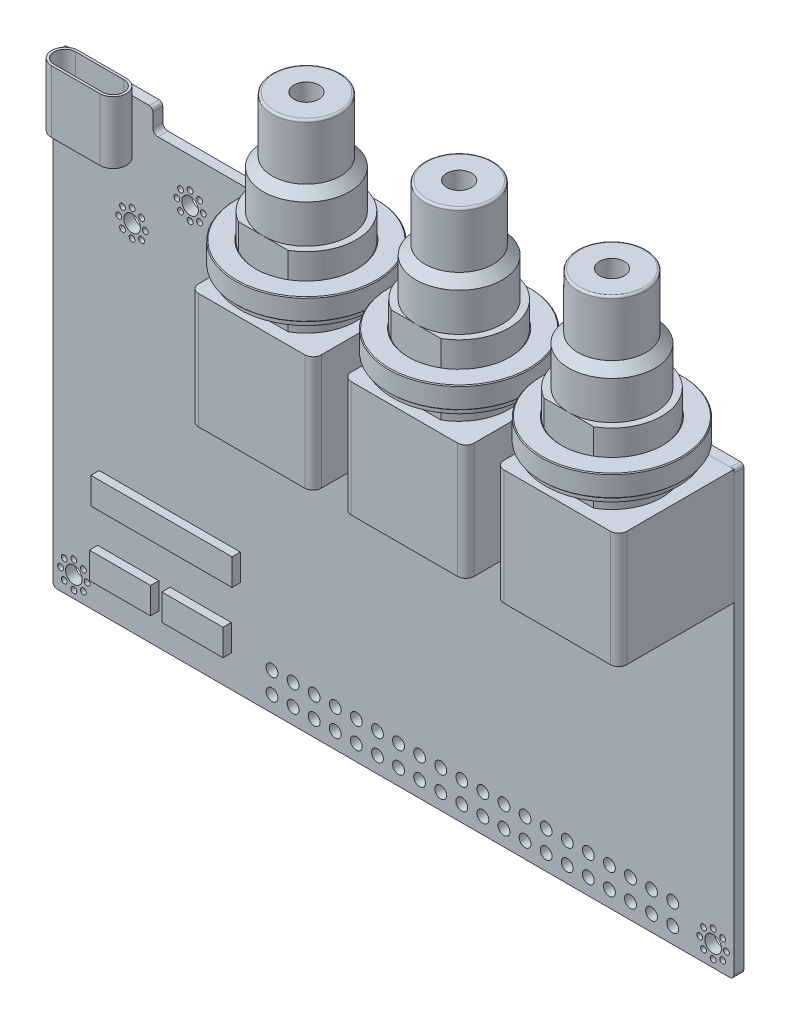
SolidWorks part; units mm, degrees
ref_plane "Front Plane" through (0, 0, 0) normal (0, 0, 1) x (1, 0, 0)
ref_plane "Top Plane" through (0, 0, 0) normal (0, 1, 0) x (1, 0, 0)
ref_plane "Right Plane" through (0, 0, 0) normal (1, 0, 0) x (0, 0, -1)
sketch "BOT" plane through (0, 0, 0) normal (0, 0, 1) x (1, 0, 0)
  line L0 (10.1712, -64.7945) -> (10.1709, -65.5945)
  line L1 (11.1708, -65.595) -> (11.1712, -64.795)
  line L2 (1.5312, -64.7903) -> (1.5308, -65.5903)
  line L3 (2.5308, -65.5908) -> (2.5312, -64.7908)
  line L4 (10.1734, -60.4645) -> (10.1728, -61.5645)
  line L5 (11.1728, -61.565) -> (11.1733, -60.465)
  line L6 (1.5333, -60.4603) -> (1.5328, -61.5603)
  line L7 (2.5328, -61.5608) -> (2.5333, -60.4608)
  line L8 (75.7902, -14.1213) -> (75.7895, -15.5437)
  line L9 (75.7895, -15.5437) -> (74.3671, -15.543)
  line L10 (74.3671, -15.543) -> (74.3678, -14.1206)
  line L11 (74.3678, -14.1206) -> (75.7902, -14.1213)
  line L12 (76.348, -16.1028) -> (25.548, -16.078)
  line L13 (25.548, -16.078) -> (25.5505, -10.998)
  line L14 (25.5505, -10.998) -> (76.3505, -11.0228)
  line L15 (76.3505, -11.0228) -> (76.348, -16.1028)
  line L16 (82.425, -63.2104) -> (82.4505, -10.8658)
  line L17 (81.9508, -10.3655) -> (0.9508, -10.326)
  line L18 (0.4506, -10.8258) -> (0.4481, -18.3065)
  line L19 (0.4481, -18.3065) -> (0.4249, -65.8599)
  line L20 (0.9235, -66.326) -> (6.1995, -66.3286)
  line L21 (6.1995, -66.3286) -> (12.0127, -66.3314)
  line L22 (12.4366, -65.8586) -> (12.4374, -64.1949)
  line L23 (13.0498, -63.5856) -> (82.0209, -63.6192)
  line L24 (10.1712, -64.7945) -> (10.1709, -65.5945)
  line L25 (11.1708, -65.595) -> (11.1712, -64.795)
  line L26 (1.5312, -64.7903) -> (1.5308, -65.5903)
  line L27 (2.5308, -65.5908) -> (2.5312, -64.7908)
  line L28 (10.1734, -60.4645) -> (10.1728, -61.5645)
  line L29 (11.1728, -61.565) -> (11.1733, -60.465)
  line L30 (1.5333, -60.4603) -> (1.5328, -61.5603)
  line L31 (2.5328, -61.5608) -> (2.5333, -60.4608)
  line L32 (75.7902, -14.1213) -> (75.7895, -15.5437)
  line L33 (75.7895, -15.5437) -> (74.3671, -15.543)
  line L34 (74.3671, -15.543) -> (74.3678, -14.1206)
  line L35 (74.3678, -14.1206) -> (75.7902, -14.1213)
  line L36 (76.348, -16.1028) -> (25.548, -16.078)
  line L37 (25.548, -16.078) -> (25.5505, -10.998)
  line L38 (25.5505, -10.998) -> (76.3505, -11.0228)
  line L39 (76.3505, -11.0228) -> (76.348, -16.1028)
  line L40 (82.425, -63.2104) -> (82.4505, -10.8658)
  line L41 (81.9508, -10.3655) -> (0.9508, -10.326)
  line L42 (0.4506, -10.8258) -> (0.4481, -18.3065)
  line L43 (0.4481, -18.3065) -> (0.4249, -65.8599)
  line L44 (0.9235, -66.326) -> (6.1995, -66.3286)
  line L45 (6.1995, -66.3286) -> (12.0127, -66.3314)
  line L46 (12.4366, -65.8586) -> (12.4374, -64.1949)
  line L47 (13.0498, -63.5856) -> (82.0209, -63.6192)
  line L48 (77.0382, -15.3161) -> (76.4548, -15.3158) construction
  line L49 (78.0554, -12.7766) -> (76.583, -12.7759) construction
  line L50 (25.2221, -15.4179) -> (23.6108, -15.4171) construction
  line L51 (25.2235, -12.4969) -> (23.6122, -12.4961) construction
  line L52 (77.0382, -15.3161) -> (76.4548, -15.3158) construction
  line L53 (78.0554, -12.7766) -> (76.583, -12.7759) construction
  line L54 (25.2221, -15.4179) -> (23.6108, -15.4171) construction
  line L55 (25.2235, -12.4969) -> (23.6122, -12.4961) construction
  circle A0 centre (9.2428, -61.5141) radius 0.325
  circle A1 centre (3.4628, -61.5112) radius 0.325
  circle A2 centre (4.5496, -12.8278) radius 0.35
  circle A3 centre (4.1001, -11.6775) radius 0.35
  circle A4 centre (2.9504, -11.227) radius 0.35
  circle A5 centre (1.8001, -11.6764) radius 0.35
  circle A6 centre (1.3496, -12.8262) radius 0.35
  circle A7 centre (4.099, -13.9776) radius 0.35
  circle A8 centre (2.9488, -14.427) radius 0.35
  circle A9 centre (2.9496, -12.827) radius 2
  circle A10 centre (1.799, -13.9764) radius 0.35
  circle A11 centre (81.5496, -12.8653) radius 0.35
  circle A12 centre (81.1001, -11.7151) radius 0.35
  circle A13 centre (79.9503, -11.2645) radius 0.35
  circle A14 centre (78.8001, -11.714) radius 0.35
  circle A15 centre (78.3496, -12.8637) radius 0.35
  circle A16 centre (81.099, -14.0151) radius 0.35
  circle A17 centre (79.9488, -14.4645) radius 0.35
  circle A18 centre (79.9496, -12.8645) radius 2
  circle A19 centre (78.799, -14.014) radius 0.35
  circle A20 centre (11.545, -53.01) radius 0.35
  circle A21 centre (11.0956, -51.8597) radius 0.35
  circle A22 centre (9.9458, -51.4092) radius 0.35
  circle A23 centre (8.7955, -51.8586) radius 0.35
  circle A24 centre (8.345, -53.0084) radius 0.35
  circle A25 centre (11.0944, -54.1598) radius 0.35
  circle A26 centre (9.9442, -54.6092) radius 0.35
  circle A27 centre (9.945, -53.0092) radius 2
  circle A28 centre (8.7944, -54.1586) radius 0.35
  circle A29 centre (18.5274, -58.3346) radius 0.35
  circle A30 centre (18.078, -57.1844) radius 0.35
  circle A31 centre (16.9282, -56.7338) radius 0.35
  circle A32 centre (15.7779, -57.1832) radius 0.35
  circle A33 centre (15.3274, -58.333) radius 0.35
  circle A34 centre (18.0768, -59.4844) radius 0.35
  circle A35 centre (16.9266, -59.9338) radius 0.35
  circle A36 centre (16.9274, -58.3338) radius 2
  circle A37 centre (15.7768, -59.4833) radius 0.35
  circle A38 centre (67.5274, -58.3585) radius 0.35
  circle A39 centre (67.078, -57.2083) radius 0.35
  circle A40 centre (65.9282, -56.7577) radius 0.35
  circle A41 centre (64.7779, -57.2071) radius 0.35
  circle A42 centre (64.3274, -58.3569) radius 0.35
  circle A43 centre (67.0768, -59.5083) radius 0.35
  circle A44 centre (65.9266, -59.9577) radius 0.35
  circle A45 centre (65.9274, -58.3577) radius 2
  circle A46 centre (64.7768, -59.5072) radius 0.35
  circle A47 centre (72.5386, -14.8309) radius 0.7112
  circle A48 centre (69.9986, -14.8297) radius 0.7112
  circle A49 centre (67.4586, -14.8284) radius 0.7112
  circle A50 centre (64.9186, -14.8272) radius 0.7112
  circle A51 centre (62.3786, -14.826) radius 0.7112
  circle A52 centre (59.8386, -14.8247) radius 0.7112
  circle A53 centre (57.2986, -14.8235) radius 0.7112
  circle A54 centre (54.7586, -14.8222) radius 0.7112
  circle A55 centre (52.2186, -14.821) radius 0.7112
  circle A56 centre (49.6786, -14.8198) radius 0.7112
  circle A57 centre (47.1386, -14.8185) radius 0.7112
  circle A58 centre (44.5986, -14.8173) radius 0.7112
  circle A59 centre (42.0586, -14.8161) radius 0.7112
  circle A60 centre (39.5186, -14.8148) radius 0.7112
  circle A61 centre (36.9786, -14.8136) radius 0.7112
  circle A62 centre (34.4386, -14.8123) radius 0.7112
  circle A63 centre (31.8986, -14.8111) radius 0.7112
  circle A64 centre (29.3586, -14.8099) radius 0.7112
  circle A65 centre (26.8186, -14.8086) radius 0.7112
  circle A66 centre (75.0799, -12.2922) radius 0.7112
  circle A67 centre (72.5399, -12.2909) radius 0.7112
  circle A68 centre (69.9999, -12.2897) radius 0.7112
  circle A69 centre (67.4599, -12.2884) radius 0.7112
  circle A70 centre (64.9199, -12.2872) radius 0.7112
  circle A71 centre (62.3799, -12.286) radius 0.7112
  circle A72 centre (59.8399, -12.2847) radius 0.7112
  circle A73 centre (57.2999, -12.2835) radius 0.7112
  circle A74 centre (54.7599, -12.2822) radius 0.7112
  circle A75 centre (52.2199, -12.281) radius 0.7112
  circle A76 centre (49.6799, -12.2798) radius 0.7112
  circle A77 centre (47.1399, -12.2785) radius 0.7112
  circle A78 centre (44.5999, -12.2773) radius 0.7112
  circle A79 centre (42.0599, -12.2761) radius 0.7112
  circle A80 centre (39.5199, -12.2748) radius 0.7112
  circle A81 centre (36.9799, -12.2736) radius 0.7112
  circle A82 centre (34.4399, -12.2723) radius 0.7112
  circle A83 centre (31.8999, -12.2711) radius 0.7112
  circle A84 centre (29.3599, -12.2699) radius 0.7112
  circle A85 centre (26.8199, -12.2686) radius 0.7112
  circle A86 centre (61.6924, -56.2094) radius 1.5
  circle A87 centre (51.5924, -56.2045) radius 1.5
  circle A88 centre (54.1449, -51.1057) radius 0.8
  circle A89 centre (56.6449, -51.107) radius 0.8
  circle A90 centre (80.0924, -56.2184) radius 1.5
  circle A91 centre (69.9924, -56.2135) radius 1.5
  circle A92 centre (72.5449, -51.1147) radius 0.8
  circle A93 centre (75.0449, -51.1159) radius 0.8
  circle A94 centre (43.2924, -56.2004) radius 1.5
  circle A95 centre (33.1924, -56.1955) radius 1.5
  circle A96 centre (35.7449, -51.0968) radius 0.8
  circle A97 centre (38.2449, -51.098) radius 0.8
  circle A98 centre (9.2428, -61.5141) radius 0.325
  circle A99 centre (3.4628, -61.5112) radius 0.325
  circle A100 centre (4.5496, -12.8278) radius 0.35
  circle A101 centre (4.1001, -11.6775) radius 0.35
  circle A102 centre (2.9504, -11.227) radius 0.35
  circle A103 centre (1.8001, -11.6764) radius 0.35
  circle A104 centre (1.3496, -12.8262) radius 0.35
  circle A105 centre (4.099, -13.9776) radius 0.35
  circle A106 centre (2.9488, -14.427) radius 0.35
  circle A107 centre (2.9496, -12.827) radius 2
  circle A108 centre (1.799, -13.9764) radius 0.35
  circle A109 centre (81.5496, -12.8653) radius 0.35
  circle A110 centre (81.1001, -11.7151) radius 0.35
  circle A111 centre (79.9503, -11.2645) radius 0.35
  circle A112 centre (78.8001, -11.714) radius 0.35
  circle A113 centre (78.3496, -12.8637) radius 0.35
  circle A114 centre (81.099, -14.0151) radius 0.35
  circle A115 centre (79.9488, -14.4645) radius 0.35
  circle A116 centre (79.9496, -12.8645) radius 2
  circle A117 centre (78.799, -14.014) radius 0.35
  circle A118 centre (11.545, -53.01) radius 0.35
  circle A119 centre (11.0956, -51.8597) radius 0.35
  circle A120 centre (9.9458, -51.4092) radius 0.35
  circle A121 centre (8.7955, -51.8586) radius 0.35
  circle A122 centre (8.345, -53.0084) radius 0.35
  circle A123 centre (11.0944, -54.1598) radius 0.35
  circle A124 centre (9.9442, -54.6092) radius 0.35
  circle A125 centre (9.945, -53.0092) radius 2
  circle A126 centre (8.7944, -54.1586) radius 0.35
  circle A127 centre (18.5274, -58.3346) radius 0.35
  circle A128 centre (18.078, -57.1844) radius 0.35
  circle A129 centre (16.9282, -56.7338) radius 0.35
  circle A130 centre (15.7779, -57.1832) radius 0.35
  circle A131 centre (15.3274, -58.333) radius 0.35
  circle A132 centre (18.0768, -59.4844) radius 0.35
  circle A133 centre (16.9266, -59.9338) radius 0.35
  circle A134 centre (16.9274, -58.3338) radius 2
  circle A135 centre (15.7768, -59.4833) radius 0.35
  circle A136 centre (67.5274, -58.3585) radius 0.35
  circle A137 centre (67.078, -57.2083) radius 0.35
  circle A138 centre (65.9282, -56.7577) radius 0.35
  circle A139 centre (64.7779, -57.2071) radius 0.35
  circle A140 centre (64.3274, -58.3569) radius 0.35
  circle A141 centre (67.0768, -59.5083) radius 0.35
  circle A142 centre (65.9266, -59.9577) radius 0.35
  circle A143 centre (65.9274, -58.3577) radius 2
  circle A144 centre (64.7768, -59.5072) radius 0.35
  circle A145 centre (72.5386, -14.8309) radius 0.7112
  circle A146 centre (69.9986, -14.8297) radius 0.7112
  circle A147 centre (67.4586, -14.8284) radius 0.7112
  circle A148 centre (64.9186, -14.8272) radius 0.7112
  circle A149 centre (62.3786, -14.826) radius 0.7112
  circle A150 centre (59.8386, -14.8247) radius 0.7112
  circle A151 centre (57.2986, -14.8235) radius 0.7112
  circle A152 centre (54.7586, -14.8222) radius 0.7112
  circle A153 centre (52.2186, -14.821) radius 0.7112
  circle A154 centre (49.6786, -14.8198) radius 0.7112
  circle A155 centre (47.1386, -14.8185) radius 0.7112
  circle A156 centre (44.5986, -14.8173) radius 0.7112
  circle A157 centre (42.0586, -14.8161) radius 0.7112
  circle A158 centre (39.5186, -14.8148) radius 0.7112
  circle A159 centre (36.9786, -14.8136) radius 0.7112
  circle A160 centre (34.4386, -14.8123) radius 0.7112
  circle A161 centre (31.8986, -14.8111) radius 0.7112
  circle A162 centre (29.3586, -14.8099) radius 0.7112
  circle A163 centre (26.8186, -14.8086) radius 0.7112
  circle A164 centre (75.0799, -12.2922) radius 0.7112
  circle A165 centre (72.5399, -12.2909) radius 0.7112
  circle A166 centre (69.9999, -12.2897) radius 0.7112
  circle A167 centre (67.4599, -12.2884) radius 0.7112
  circle A168 centre (64.9199, -12.2872) radius 0.7112
  circle A169 centre (62.3799, -12.286) radius 0.7112
  circle A170 centre (59.8399, -12.2847) radius 0.7112
  circle A171 centre (57.2999, -12.2835) radius 0.7112
  circle A172 centre (54.7599, -12.2822) radius 0.7112
  circle A173 centre (52.2199, -12.281) radius 0.7112
  circle A174 centre (49.6799, -12.2798) radius 0.7112
  circle A175 centre (47.1399, -12.2785) radius 0.7112
  circle A176 centre (44.5999, -12.2773) radius 0.7112
  circle A177 centre (42.0599, -12.2761) radius 0.7112
  circle A178 centre (39.5199, -12.2748) radius 0.7112
  circle A179 centre (36.9799, -12.2736) radius 0.7112
  circle A180 centre (34.4399, -12.2723) radius 0.7112
  circle A181 centre (31.8999, -12.2711) radius 0.7112
  circle A182 centre (29.3599, -12.2699) radius 0.7112
  circle A183 centre (26.8199, -12.2686) radius 0.7112
  circle A184 centre (61.6924, -56.2094) radius 1.5
  circle A185 centre (51.5924, -56.2045) radius 1.5
  circle A186 centre (54.1449, -51.1057) radius 0.8
  circle A187 centre (56.6449, -51.107) radius 0.8
  circle A188 centre (80.0924, -56.2184) radius 1.5
  circle A189 centre (69.9924, -56.2135) radius 1.5
  circle A190 centre (72.5449, -51.1147) radius 0.8
  circle A191 centre (75.0449, -51.1159) radius 0.8
  circle A192 centre (43.2924, -56.2004) radius 1.5
  circle A193 centre (33.1924, -56.1955) radius 1.5
  circle A194 centre (35.7449, -51.0968) radius 0.8
  circle A195 centre (38.2449, -51.098) radius 0.8
  arc A196 (10.1709, -65.5945) -> (11.1708, -65.595) centre (10.6708, -65.5948) ccw
  arc A197 (11.1712, -64.795) -> (10.1712, -64.7945) centre (10.6712, -64.7948) ccw
  arc A198 (1.5308, -65.5903) -> (2.5308, -65.5908) centre (2.0308, -65.5906) ccw
  arc A199 (2.5312, -64.7908) -> (1.5312, -64.7903) centre (2.0312, -64.7906) ccw
  arc A200 (10.1728, -61.5645) -> (11.1728, -61.565) centre (10.6728, -61.5648) ccw
  arc A201 (11.1733, -60.465) -> (10.1734, -60.4645) centre (10.6734, -60.4648) ccw
  arc A202 (1.5328, -61.5603) -> (2.5328, -61.5608) centre (2.0328, -61.5605) ccw
  arc A203 (2.5333, -60.4608) -> (1.5333, -60.4603) centre (2.0333, -60.4606) ccw
  arc A204 (82.4505, -10.8658) -> (81.9508, -10.3655) centre (81.9505, -10.8655) ccw
  arc A205 (0.9508, -10.326) -> (0.4506, -10.8258) centre (0.9505, -10.826) ccw
  arc A206 (0.4249, -65.8599) -> (0.9235, -66.326) centre (0.9237, -65.826) ccw
  arc A207 (12.0127, -66.3314) -> (12.4366, -65.8586) centre (11.9606, -65.8583) ccw
  arc A208 (13.0498, -63.5856) -> (12.4374, -64.1949) centre (13.0495, -64.1977) ccw
  arc A209 (82.0209, -63.6192) -> (82.425, -63.2104) centre (82.016, -63.2102) ccw
  arc A210 (10.1709, -65.5945) -> (11.1708, -65.595) centre (10.6708, -65.5948) ccw
  arc A211 (11.1712, -64.795) -> (10.1712, -64.7945) centre (10.6712, -64.7948) ccw
  arc A212 (1.5308, -65.5903) -> (2.5308, -65.5908) centre (2.0308, -65.5906) ccw
  arc A213 (2.5312, -64.7908) -> (1.5312, -64.7903) centre (2.0312, -64.7906) ccw
  arc A214 (10.1728, -61.5645) -> (11.1728, -61.565) centre (10.6728, -61.5648) ccw
  arc A215 (11.1733, -60.465) -> (10.1734, -60.4645) centre (10.6734, -60.4648) ccw
  arc A216 (1.5328, -61.5603) -> (2.5328, -61.5608) centre (2.0328, -61.5605) ccw
  arc A217 (2.5333, -60.4608) -> (1.5333, -60.4603) centre (2.0333, -60.4606) ccw
  arc A218 (82.4505, -10.8658) -> (81.9508, -10.3655) centre (81.9505, -10.8655) ccw
  arc A219 (0.9508, -10.326) -> (0.4506, -10.8258) centre (0.9505, -10.826) ccw
  arc A220 (0.4249, -65.8599) -> (0.9235, -66.326) centre (0.9237, -65.826) ccw
  arc A221 (12.0127, -66.3314) -> (12.4366, -65.8586) centre (11.9606, -65.8583) ccw
  arc A222 (13.0498, -63.5856) -> (12.4374, -64.1949) centre (13.0495, -64.1977) ccw
  arc A223 (82.0209, -63.6192) -> (82.425, -63.2104) centre (82.016, -63.2102) ccw
  text T0 "1" font "SWTXT" height 0.889
  text T1 "21" font "SWTXT" height 0.889
  text T2 "20" font "SWTXT" height 0.889
  text T3 "40" font "SWTXT" height 0.889
  text T4 "1" font "SWTXT" height 0.889
  text T5 "21" font "SWTXT" height 0.889
  text T6 "20" font "SWTXT" height 0.889
  text T7 "40" font "SWTXT" height 0.889
sketch "TOP" plane through (0, 0, 0) normal (0, 0, 1) x (1, 0, 0)
  line L0 (1.427, 57.464) -> (1.427, 50.114) construction
  line L1 (10.427, 50.114) -> (10.427, 57.464) construction
  line L2 (1.427, 50.114) -> (10.427, 50.114) construction
  line L3 (6.8368, 1.616) -> (6.8368, 0.416) construction
  line L4 (9.4368, 1.616) -> (9.4368, 0.416) construction
  line L5 (5.3719, 7.01) -> (12.7379, 7.01) construction
  line L6 (14.1021, 7.01) -> (21.4681, 7.01) construction
  line L7 (5.555, 14.9028) -> (22.555, 14.9028) construction
  line L730 (5.555, 14.9028) -> (5.555, 11.7028) construction
  line L731 (5.555, 11.7028) -> (22.555, 11.7028) construction
  line L732 (22.555, 11.7028) -> (22.555, 14.9028) construction
  line L806 (10.427, 57.464) -> (1.427, 57.464) construction
  line L865 (5.3719, 3.835) -> (5.3719, 7.01) construction
  line L866 (12.7379, 3.835) -> (5.3719, 3.835) construction
  line L867 (12.7379, 7.01) -> (12.7379, 3.835) construction
  line L918 (14.1021, 3.835) -> (14.1021, 7.01) construction
  line L919 (21.4681, 3.835) -> (14.1021, 3.835) construction
  line L920 (21.4681, 7.01) -> (21.4681, 3.835) construction
  line L1002 (48.814, 53.2538) -> (48.814, 39.3428) construction
  line L1003 (48.814, 39.3428) -> (63.614, 39.3428) construction
  line L1004 (63.614, 39.3428) -> (63.614, 53.2538) construction
  line L1005 (63.614, 53.2538) -> (48.814, 53.2538) construction
  line L1006 (60.614, 53.2538) -> (60.614, 62.1538) construction
  line L1007 (60.614, 62.1538) -> (51.814, 62.1538) construction
  line L1008 (51.814, 62.1538) -> (51.814, 53.2536) construction
  line L1009 (67.214, 53.2538) -> (67.214, 39.3428) construction
  line L1010 (67.214, 39.3428) -> (82.014, 39.3428) construction
  line L1011 (82.014, 39.3428) -> (82.014, 53.2538) construction
  line L1012 (82.014, 53.2538) -> (67.214, 53.2538) construction
  line L1013 (79.014, 53.2538) -> (79.014, 62.1538) construction
  line L1014 (79.014, 62.1538) -> (70.214, 62.1538) construction
  line L1015 (70.214, 62.1538) -> (70.214, 53.2536) construction
  line L1016 (30.414, 53.2538) -> (30.414, 39.3428) construction
  line L1017 (30.414, 39.3428) -> (45.214, 39.3428) construction
  line L1018 (45.214, 39.3428) -> (45.214, 53.2538) construction
  line L1019 (45.214, 53.2538) -> (30.414, 53.2538) construction
  line L1020 (42.214, 53.2538) -> (42.214, 62.1538) construction
  line L1021 (42.214, 62.1538) -> (33.414, 62.1538) construction
  line L1022 (33.414, 62.1538) -> (33.414, 53.2536) construction
  line L1039 (9.0368, 0.416) -> (9.4368, 0.416) construction
  line L1042 (6.8368, 0.416) -> (7.2368, 0.416) construction
  line L1044 (9.4368, 1.616) -> (6.8368, 1.616) construction
  line L1046 (82, 52.8447) -> (82, 0.5)
  line L1047 (81.5, 0) -> (0.5, 0)
  line L1048 (0, 0.5) -> (0.0012, 7.9807)
  line L1049 (0.0012, 7.9807) -> (0.0012, 55.5342)
  line L1050 (0.5, 56) -> (5.776, 56)
  line L1051 (5.776, 56) -> (11.5892, 56)
  line L1052 (12.0128, 55.5269) -> (12.0128, 53.8632)
  line L1053 (12.625, 53.2536) -> (81.5961, 53.2536)
  circle A0 centre (2.5, 2.5) radius 1
  circle A1 centre (16.5, 48) radius 1
  circle A2 centre (9.515, 42.6788) radius 1
  circle A3 centre (4.1, 2.5) radius 0.35
  circle A4 centre (3.65, 1.35) radius 0.35
  circle A5 centre (2.5, 0.9) radius 0.35
  circle A6 centre (1.35, 1.35) radius 0.35
  circle A7 centre (0.9, 2.5) radius 0.35
  circle A8 centre (3.65, 3.65) radius 0.35
  circle A9 centre (2.5, 4.1) radius 0.35
  circle A11 centre (1.35, 3.65) radius 0.35
  circle A12 centre (81.1, 2.5) radius 0.35
  circle A13 centre (80.65, 1.35) radius 0.35
  circle A14 centre (79.5, 0.9) radius 0.35
  circle A15 centre (78.35, 1.35) radius 0.35
  circle A16 centre (77.9, 2.5) radius 0.35
  circle A17 centre (80.65, 3.65) radius 0.35
  circle A18 centre (79.5, 4.1) radius 0.35
  circle A20 centre (78.35, 3.65) radius 0.35
  circle A21 centre (11.115, 42.6788) radius 0.35
  circle A22 centre (10.665, 41.5288) radius 0.35
  circle A23 centre (9.515, 41.0788) radius 0.35
  circle A24 centre (8.365, 41.5288) radius 0.35
  circle A25 centre (7.915, 42.6788) radius 0.35
  circle A26 centre (10.665, 43.8288) radius 0.35
  circle A27 centre (9.515, 44.2788) radius 0.35
  circle A29 centre (8.365, 43.8288) radius 0.35
  circle A30 centre (18.1, 48) radius 0.35
  circle A31 centre (17.65, 46.85) radius 0.35
  circle A32 centre (16.5, 46.4) radius 0.35
  circle A33 centre (15.35, 46.85) radius 0.35
  circle A34 centre (14.9, 48) radius 0.35
  circle A35 centre (17.65, 49.15) radius 0.35
  circle A36 centre (16.5, 49.6) radius 0.35
  circle A38 centre (15.35, 49.15) radius 0.35
  circle A39 centre (67.1, 48) radius 0.35
  circle A40 centre (66.65, 46.85) radius 0.35
  circle A41 centre (65.5, 46.4) radius 0.35
  circle A42 centre (64.35, 46.85) radius 0.35
  circle A43 centre (63.9, 48) radius 0.35
  circle A44 centre (66.65, 49.15) radius 0.35
  circle A45 centre (65.5, 49.6) radius 0.35
  circle A47 centre (64.35, 49.15) radius 0.35
  circle A48 centre (72.09, 4.47) radius 0.7112
  circle A49 centre (69.55, 4.47) radius 0.7112
  circle A50 centre (67.01, 4.47) radius 0.7112
  circle A51 centre (64.47, 4.47) radius 0.7112
  circle A52 centre (61.93, 4.47) radius 0.7112
  circle A53 centre (59.39, 4.47) radius 0.7112
  circle A54 centre (56.85, 4.47) radius 0.7112
  circle A55 centre (54.31, 4.47) radius 0.7112
  circle A56 centre (51.77, 4.47) radius 0.7112
  circle A57 centre (49.23, 4.47) radius 0.7112
  circle A58 centre (46.69, 4.47) radius 0.7112
  circle A59 centre (44.15, 4.47) radius 0.7112
  circle A60 centre (41.61, 4.47) radius 0.7112
  circle A61 centre (39.07, 4.47) radius 0.7112
  circle A62 centre (36.53, 4.47) radius 0.7112
  circle A63 centre (33.99, 4.47) radius 0.7112
  circle A64 centre (31.45, 4.47) radius 0.7112
  circle A65 centre (28.91, 4.47) radius 0.7112
  circle A66 centre (26.37, 4.47) radius 0.7112
  circle A67 centre (74.63, 1.93) radius 0.7112
  circle A68 centre (72.09, 1.93) radius 0.7112
  circle A69 centre (69.55, 1.93) radius 0.7112
  circle A70 centre (67.01, 1.93) radius 0.7112
  circle A71 centre (64.47, 1.93) radius 0.7112
  circle A72 centre (61.93, 1.93) radius 0.7112
  circle A73 centre (59.39, 1.93) radius 0.7112
  circle A74 centre (56.85, 1.93) radius 0.7112
  circle A75 centre (54.31, 1.93) radius 0.7112
  circle A76 centre (51.77, 1.93) radius 0.7112
  circle A77 centre (49.23, 1.93) radius 0.7112
  circle A78 centre (46.69, 1.93) radius 0.7112
  circle A79 centre (44.15, 1.93) radius 0.7112
  circle A80 centre (41.61, 1.93) radius 0.7112
  circle A81 centre (39.07, 1.93) radius 0.7112
  circle A82 centre (36.53, 1.93) radius 0.7112
  circle A83 centre (33.99, 1.93) radius 0.7112
  circle A84 centre (31.45, 1.93) radius 0.7112
  circle A85 centre (28.91, 1.93) radius 0.7112
  circle A86 centre (26.37, 1.93) radius 0.7112
  circle A87 centre (65.5, 48) radius 1
  circle A88 centre (79.5, 2.5) radius 1
  circle A89 centre (74.63, 4.47) radius 0.7112
  arc A107 (8.1368, 0.016) -> (9.0368, 0.416) centre (8.2268, 1.026) ccw construction
  arc A108 (7.2368, 0.416) -> (8.1368, 0.016) centre (8.105, 1.1569) ccw construction
  arc A109 (81.5, 0) -> (82, 0.5) centre (81.5, 0.5) ccw
  arc A110 (0, 0.5) -> (0.5, 0) centre (0.5, 0.5) ccw
  arc A111 (0.5, 56) -> (0.0012, 55.5342) centre (0.5, 55.5) ccw
  arc A112 (12.0128, 55.5269) -> (11.5892, 56) centre (11.5369, 55.5269) ccw
  arc A113 (12.0128, 53.8632) -> (12.625, 53.2536) centre (12.625, 53.8658) ccw
  arc A114 (82, 52.8447) -> (81.5961, 53.2536) centre (81.591, 52.8447) ccw
extrude "Boss-Extrude1" add sketch "TOP" against normal blind 1.2
sketch "Sketch3" plane through (0, 0, 0) normal (0, 0, 1) x (1, 0, 0)
  line L0 (5.555, 14.9028) -> (5.555, 11.7028) construction
  line L1 (5.555, 14.9028) -> (22.555, 14.9028) construction
  line L2 (22.555, 11.7028) -> (22.555, 14.9028) construction
  line L3 (5.555, 11.7028) -> (22.555, 11.7028) construction
  line L4 (5.3719, 7.01) -> (12.7379, 7.01) construction
  line L5 (5.3719, 3.835) -> (5.3719, 7.01) construction
  line L6 (12.7379, 7.01) -> (12.7379, 3.835) construction
  line L7 (14.1021, 3.835) -> (14.1021, 7.01) construction
  line L8 (14.1021, 7.01) -> (21.4681, 7.01) construction
  line L9 (21.4681, 7.01) -> (21.4681, 3.835) construction
  line L10 (21.4681, 3.835) -> (14.1021, 3.835) construction
  line L11 (12.7379, 3.835) -> (5.3719, 3.835) construction
  line L12 (5.555, 14.9028) -> (5.555, 11.7028)
  line L13 (5.555, 14.9028) -> (22.555, 14.9028)
  line L14 (22.555, 11.7028) -> (22.555, 14.9028)
  line L15 (5.555, 11.7028) -> (22.555, 11.7028)
  line L16 (5.3719, 7.01) -> (12.7379, 7.01)
  line L17 (5.3719, 3.835) -> (5.3719, 7.01)
  line L18 (12.7379, 7.01) -> (12.7379, 3.835)
  line L19 (14.1021, 3.835) -> (14.1021, 7.01)
  line L20 (14.1021, 7.01) -> (21.4681, 7.01)
  line L21 (21.4681, 7.01) -> (21.4681, 3.835)
  line L22 (21.4681, 3.835) -> (14.1021, 3.835)
  line L23 (12.7379, 3.835) -> (5.3719, 3.835)
extrude "Boss-Extrude2" add sketch "Sketch3" along normal blind 1 separate body
ref_plane "Plane1" through (0, 57.464, 0) normal (0, 1, 0) x (1, 0, 0)
sketch "Sketch4" plane through (0, 57.464, 0) normal (0, 1, 0) x (1, 0, 0)
  line L0 (3.027, -1.6) -> (8.827, -1.6) construction
  line L1 (3.027, 0) -> (8.827, 0)
  line L2 (3.027, -3.2) -> (8.827, -3.2)
  line L3 (5.927, -1.6) -> (5.927, 0) construction
  line L4 (10.427, 0) -> (1.427, 0) construction
  line L5 (10.427, -1.6) -> (1.427, -1.6) construction
  arc A0 (3.027, 0) -> (3.027, -3.2) centre (3.027, -1.6) ccw
  arc A1 (8.827, -3.2) -> (8.827, 0) centre (8.827, -1.6) ccw
  point P2 (5.927, -1.6)
  dimension "D1" = 3.2
  dimension "D2" = 9
extrude "Boss-Extrude3" add sketch "Sketch4" against normal blind 7.5 separate body
shell "Shell2" thickness 0.3
sketch "Sketch5" plane through (0, 0, 0) normal (0, 0, 1) x (1, 0, 0)
  line L1 (30.414, 53.2538) -> (45.214, 53.2538)
  line L2 (30.414, 53.2538) -> (30.414, 39.3428)
  line L3 (30.414, 39.3428) -> (45.214, 39.3428)
  line L4 (45.214, 53.2538) -> (45.214, 39.3428)
  line L5 (48.814, 53.2538) -> (63.614, 53.2538)
  line L6 (48.814, 53.2538) -> (48.814, 39.3428)
  line L7 (48.814, 39.3428) -> (63.614, 39.3428)
  line L8 (63.614, 53.2538) -> (63.614, 39.3428)
  line L9 (67.214, 53.2538) -> (82.014, 53.2538)
  line L10 (67.214, 53.2538) -> (67.214, 39.3428)
  line L11 (67.214, 39.3428) -> (82.014, 39.3428)
  line L12 (82.014, 53.2538) -> (82.014, 39.3428)
extrude "Boss-Extrude4" add sketch "Sketch5" along normal blind 13.9 separate body
fillet "Fillet1" radius 1 2 edges at (67.214, 46.2983, 13.9) (82.014, 46.2983, 13.9)
fillet "Fillet2" radius 1 2 edges at (63.614, 46.2983, 13.9) (48.814, 46.2983, 13.9)
fillet "Fillet3" radius 1 2 edges at (45.214, 46.2983, 13.9) (30.414, 46.2983, 13.9)
sketch "Sketch6" plane through (0, 53.2538, 0) normal (0, 1, 0) x (1, 0, 0)
  line L0 (37.814, -13.9) -> (37.814, 0) construction
  line L2 (81.5, 0) -> (0.5, 0) construction
  line L3 (56.214, -13.9) -> (56.214, 0) construction
  line L5 (74.614, -13.9) -> (74.614, 0) construction
  line L8 (81.5961, 1.2) -> (12.625, 1.2) construction
  circle A0 centre (37.814, -7.3) radius 8.5
  circle A1 centre (56.214, -7.3) radius 8.5
  circle A2 centre (74.614, -7.3) radius 8.5
  point P20 (0, 0)
  dimension "D1" = 17
extrude "Boss-Extrude5" add sketch "Sketch6" along normal blind 3.5
sketch "Sketch7" plane through (0, 56.7538, 0) normal (0, 1, 0) x (1, 0, 0)
  circle A0 centre (37.814, -7.3) radius 6
  circle A1 centre (56.214, -7.3) radius 6
  circle A2 centre (74.614, -7.3) radius 6
  dimension "D1" = 12
extrude "Boss-Extrude6" add sketch "Sketch7" along normal blind 5
sketch "Sketch8" plane through (0, 61.7538, 0) normal (0, 1, 0) x (1, 0, 0)
  circle A0 centre (37.814, -7.3) radius 5.2
  circle A1 centre (56.214, -7.3) radius 5.2
  circle A2 centre (74.614, -7.3) radius 5.2
  dimension "D1" = 10.4
extrude "Boss-Extrude7" add sketch "Sketch8" along normal blind 5.7
sketch "Sketch9" plane through (0, 67.4538, 0) normal (0, 1, 0) x (1, 0, 0)
  circle A0 centre (37.814, -7.3) radius 4.11
  circle A1 centre (56.214, -7.3) radius 4.11
  circle A2 centre (74.614, -7.3) radius 4.11
  dimension "D1" = 8.22
extrude "Boss-Extrude8" add sketch "Sketch9" along normal blind 6.7
sketch "Sketch10" plane through (0, 74.1538, 0) normal (0, 1, 0) x (1, 0, 0)
  circle A0 centre (37.814, -7.3) radius 1.5
  circle A1 centre (56.214, -7.3) radius 1.5
  circle A2 centre (74.614, -7.3) radius 1.5
  dimension "D1" = 3
extrude "Cut-Extrude1" cut sketch "Sketch10" against normal blind 10
chamfer "Chamfer1" distance 1.09 angle 45 1 edges at (74.614, 67.4538, 12.5)
chamfer "Chamfer2" distance 1.09 angle 45 1 edges at (56.214, 67.4538, 12.5)
chamfer "Chamfer3" distance 1.09 angle 45 1 edges at (37.814, 67.4538, 12.5)
fillet "Fillet4" radius 0.25 1 edges at (37.814, 74.1538, 11.41)
fillet "Fillet5" radius 0.25 1 edges at (56.214, 74.1538, 11.41)
fillet "Fillet6" radius 0.25 1 edges at (74.614, 74.1538, 11.41)
ref_plane "Plane2" through (0, 58.7538, 0) normal (0, 1, 0) x (1, 0, 0)
sketch "Sketch12" plane through (0, 56.7538, 0) normal (0, 1, 0) x (1, 0, 0)
  circle A0 centre (74.614, -7.3) radius 6 construction
  circle A1 centre (37.814, -7.3) radius 8.5
  circle A2 centre (37.814, -7.3) radius 8.5
  circle A3 centre (56.214, -7.3) radius 8.5
  circle A4 centre (56.214, -7.3) radius 8.5
  circle A5 centre (74.614, -7.3) radius 8.5
  circle A6 centre (74.614, -7.3) radius 8.5
  circle A7 centre (56.214, -7.3) radius 6 construction
  circle A8 centre (37.814, -7.3) radius 6 construction
  circle A9 centre (74.614, -7.3) radius 6
  circle A10 centre (56.214, -7.3) radius 6
  circle A11 centre (37.814, -7.3) radius 6
  dimension "D1" = 0
  dimension "D2" = 0
  dimension "D3" = 0
extrude "Cut-Extrude2" cut sketch "Sketch12" against normal up to surface (3.5 mm away)
sketch "Sketch13" plane through (0, 58.7538, 0) normal (0, 1, 0) x (1, 0, 0)
  circle A0 centre (37.814, -7.3) radius 8.5
  circle A1 centre (56.214, -7.3) radius 8.5
  circle A2 centre (74.614, -7.3) radius 8.5
  circle A3 centre (37.814, -7.3) radius 6
  circle A4 centre (56.214, -7.3) radius 6
  circle A5 centre (74.614, -7.3) radius 6
  dimension "D1" = 17
  dimension "D2" = 2.5
extrude "Boss-Extrude9" add sketch "Sketch13" against normal blind 2.6 separate body
chamfer "Chamfer4" distance 0.1 angle 45 4 edges at (37.814, 56.1538, 15.8) (37.814, 56.1538, 13.3) (37.814, 58.7538, 15.8) (37.814, 58.7538, 13.3)
chamfer "Chamfer5" distance 0.1 angle 45 4 edges at (56.214, 58.7538, 15.8) (56.214, 58.7538, 13.3) (56.214, 56.1538, 15.8) (56.214, 56.1538, 13.3)
chamfer "Chamfer6" distance 0.1 angle 45 4 edges at (74.614, 56.1538, 15.8) (74.614, 56.1538, 13.3) (74.614, 58.7538, 15.8) (74.614, 58.7538, 13.3)
ref_plane "Plane3" through (0, 55.9538, 0) normal (0, -1, 0) x (-1, 0, 0)
sketch "Sketch14" plane through (0, 55.9538, 0) normal (0, -1, 0) x (-1, 0, 0)
  circle A0 centre (-74.614, -7.3) radius 8
  circle A1 centre (-56.214, -7.3) radius 8
  circle A2 centre (-37.814, -7.3) radius 8
  circle A3 centre (-74.614, -7.3) radius 7
  circle A4 centre (-56.214, -7.3) radius 7
  circle A5 centre (-37.814, -7.3) radius 7
  dimension "D1" = 16
  dimension "D2" = 1
extrude "Boss-Extrude10" add sketch "Sketch14" along normal blind 0.5 separate body
sketch "Sketch15" plane through (0, 61.7538, 0) normal (0, 1, 0) x (1, 0, 0)
  line L0 (34.8206, -12.5) -> (40.8073, -12.5)
  line L1 (53.2207, -12.5) -> (59.2073, -12.5)
  line L2 (71.6207, -12.5) -> (77.6073, -12.5)
  circle A0 centre (37.814, -7.3) radius 6 construction
  circle A1 centre (56.214, -7.3) radius 6 construction
  circle A2 centre (74.614, -7.3) radius 6 construction
  circle A4 centre (37.814, -7.3) radius 5.2 construction
  arc A5 (71.6207, -12.5) -> (77.6073, -12.5) centre (74.614, -7.3) ccw
  arc A6 (53.2207, -12.5) -> (59.2073, -12.5) centre (56.214, -7.3) ccw
  arc A7 (34.8206, -12.5) -> (40.8073, -12.5) centre (37.814, -7.3) ccw
extrude "Cut-Extrude3" cut sketch "Sketch15" against normal up to surface (8.5 mm away)
